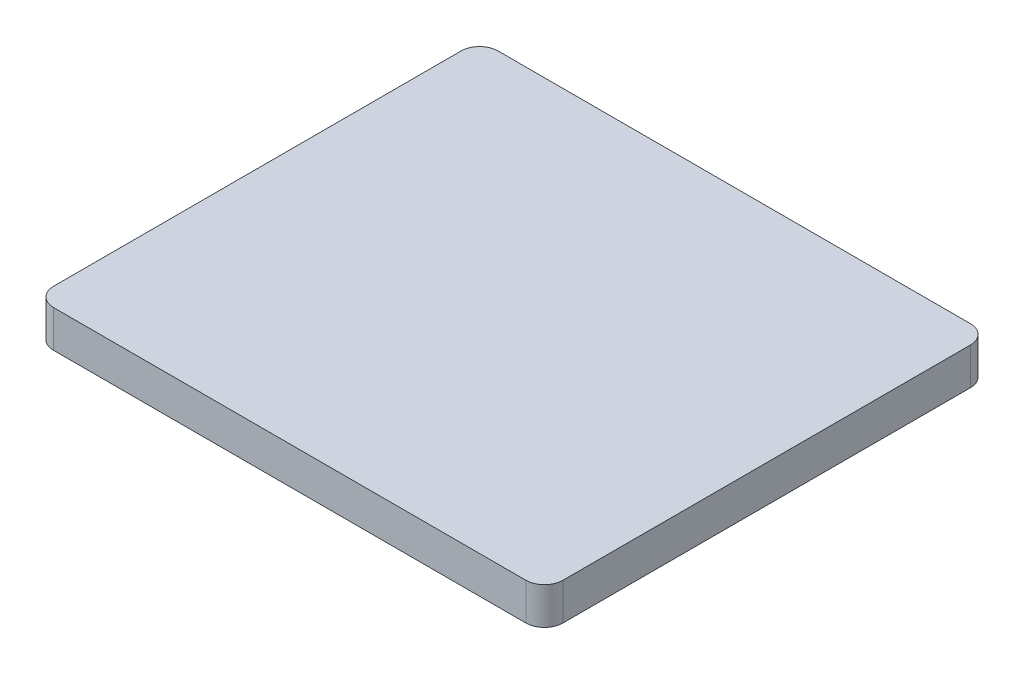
SolidWorks part; units mm, degrees
ref_plane "Front Plane" through (0, 0, 0) normal (0, 0, 1) x (1, 0, 0)
ref_plane "Top Plane" through (0, 0, 0) normal (0, 1, 0) x (1, 0, 0)
ref_plane "Right Plane" through (0, 0, 0) normal (1, 0, 0) x (0, 0, -1)
sketch "Sketch1" plane through (0, 0, 0) normal (0, 1, 0) x (1, 0, 0)
  line L1 (-275, 240) -> (275, 240)
  line L2 (-275, 240) -> (-275, -240)
  line L3 (-275, -240) -> (275, -240)
  line L4 (275, 240) -> (275, -240)
  line L5 (-275, 240) -> (275, -240) construction
  line L6 (-275, -240) -> (275, 240) construction
  point P0 (0, 0)
  dimension "D1" = 480
  dimension "D2" = 550
extrude "Boss-Extrude1" add sketch "Sketch1" along normal blind 40
fillet "Fillet1" radius 20 4 edges at (-275, 20, -240) (275, 20, -240) (275, 20, 240) (-275, 20, 240)
